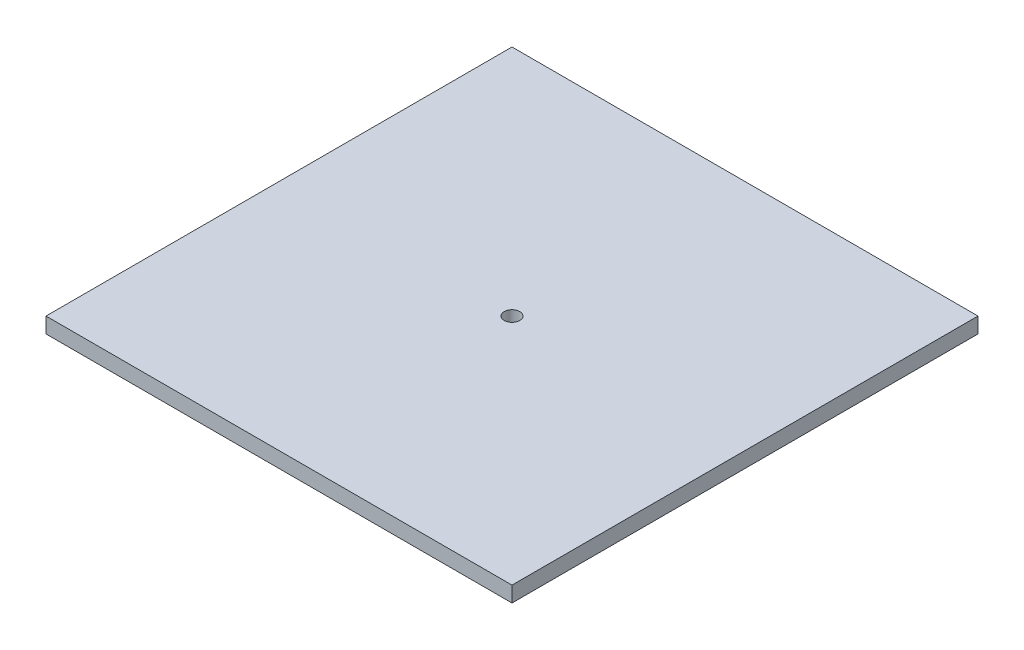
SolidWorks part; units mm, degrees
ref_plane "Plan de face" through (0, 0, 0) normal (0, 0, 1) x (1, 0, 0)
ref_plane "Plan de dessus" through (0, 0, 0) normal (0, 1, 0) x (1, 0, 0)
ref_plane "Plan de droite" through (0, 0, 0) normal (1, 0, 0) x (0, 0, -1)
sketch "Esquisse1" plane through (0, 0, 0) normal (0, 1, 0) x (1, 0, 0)
  line L0 (35.335, 90) -> (111.8438, 90) construction
  line L1 (0, 0) -> (180, 0)
  line L2 (0, 0) -> (0, 180)
  line L3 (0, 180) -> (180, 180)
  line L4 (180, 0) -> (180, 180)
  line L5 (90, 36.4438) -> (90, 102.3079) construction
  circle A0 centre (90, 90) radius 3
extrude "Extrusion1" add sketch "Esquisse1" along normal blind 6
